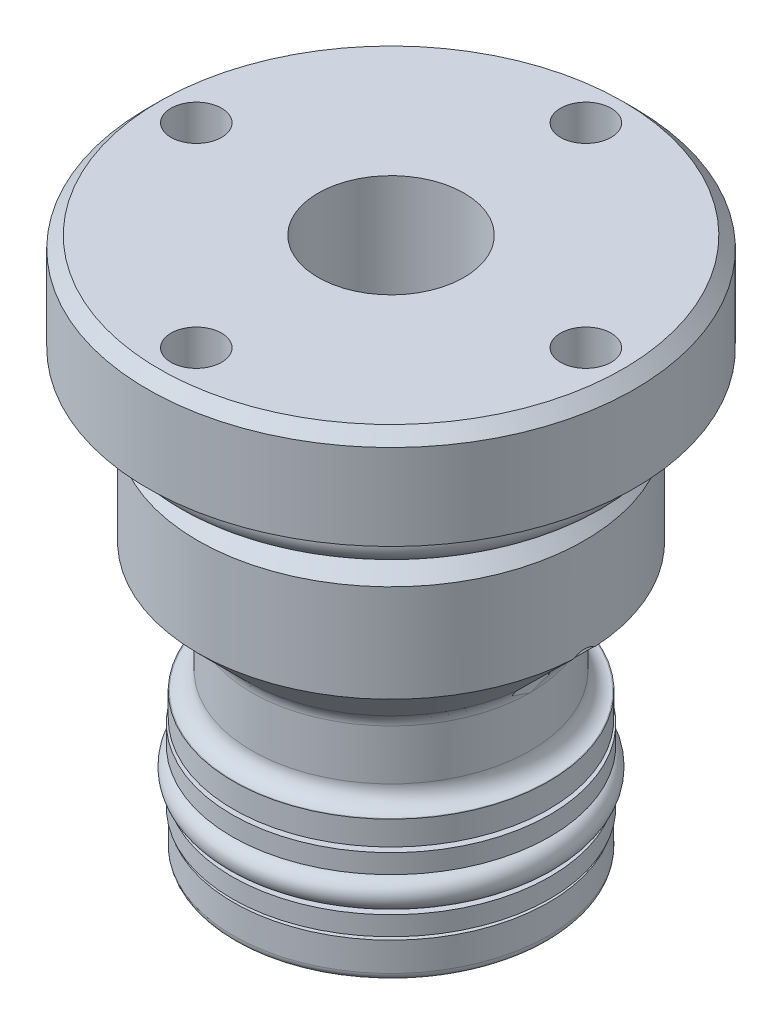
SolidWorks part; units mm, degrees
ref_plane "Front Plane" through (0, 0, 0) normal (0, 0, 1) x (1, 0, 0)
ref_plane "Top Plane" through (0, 0, 0) normal (0, 1, 0) x (1, 0, 0)
ref_plane "Right Plane" through (0, 0, 0) normal (1, 0, 0) x (0, 0, -1)
sketch "Sketch1" plane through (0, 0, 0) normal (0, 0, 1) x (1, 0, 0)
  line L0 (0, 0) -> (0, 29.1031) construction
  line L1 (-7.9375, 0) -> (-7.9375, 18.2372)
  line L2 (-7.9375, 18.2372) -> (-4.7625, 18.2372)
  line L3 (-4.7625, 18.2372) -> (-4.7625, 34.925)
  line L4 (-4.7625, 34.925) -> (-15.875, 34.925)
  line L5 (-15.875, 34.925) -> (-15.875, 28.575)
  line L6 (-15.875, 28.575) -> (-12.6111, 28.575)
  line L7 (-12.6111, 28.575) -> (-12.6111, 17.6403)
  line L8 (-12.6111, 17.6403) -> (-9.0805, 14.1097)
  line L9 (-9.0805, 14.1097) -> (-9.0805, 9.2202)
  line L10 (-9.0805, 9.2202) -> (-10.2743, 9.2202)
  line L11 (-10.2743, 9.2202) -> (-10.2743, 7.6454)
  line L12 (-10.2743, 7.6454) -> (-9.017, 7.6454)
  line L13 (-9.017, 7.6454) -> (-9.017, 2.3876)
  line L14 (-9.017, 2.3876) -> (-10.2743, 2.3876)
  line L15 (-10.2743, 2.3876) -> (-10.2743, 0)
  line L16 (-10.2743, 0) -> (-7.9375, 0)
  dimension "D1" = 18.2372
  dimension "D2" = 34.925
  dimension "D3" = 31.75
  dimension "D4" = 9.525
  dimension "D5" = 15.875
  dimension "D6" = 20.5486
  dimension "D7" = 2.3876
  dimension "D8" = 1.5748
  dimension "D9" = 18.034
  dimension "D10" = 5.2578
  dimension "D11" = 28.575
  dimension "D12" = 25.2222
  dimension "D13" = 18.161
  dimension "D14" = 10.9347
  dimension "D15" = 45
revolve "Revolve1" add sketch "Sketch1" angle 360 about L0
fillet "Fillet1" radius 1.143 2 edges at (0, 14.1097, -9.0805) (0, 9.2202, -9.0805)
fillet "Fillet2" radius 0.381 2 edges at (0, 7.6454, -9.017) (0, 2.3876, -9.017)
fillet "Fillet3" radius 0.508 1 edges at (0, 0, -10.2743)
hole_wizard "Hole1" positions "Sketch3" profile "Sketch2" legacy
sketch "Sketch3" plane through (0, 34.925, 0) normal (0, 1, 0) x (-1, 0, 0)
  circle A0 centre (0, 0) radius 12.7 construction
  point P0 (-12.7, 0)
  dimension "D1" = 12.7
sketch "Sketch2" plane through (12.7, 34.925, 0) normal (1, 0, 0) x (0, 0, 1)
  line L0 (0, 0) -> (0, 4.167)
  line L1 (0, 4.167) -> (1.651, 3.175)
  line L2 (1.651, 3.175) -> (1.651, 0)
  line L4 (1.651, 0) -> (0, 0)
  line L6 (0, 4.167) -> (-1.651, 3.175) construction
  line L7 (0, -4.2442) -> (0, 117.3081) construction
  dimension "Diameter" = 3.302
  dimension "Depth" = 3.175
  dimension "Drill Angle" = 118
pattern_circular "CirPattern1" count 4 over 360 about axis through (0, 0, 0) along (0, 1, 0) of "Hole1"
chamfer "Chamfer1" distance 0.762 angle 45 1 edges at (0, 34.925, -15.875)
sketch "Sketch4" plane through (0, 0, 0) normal (0, 0, 1) x (1, 0, 0)
  line L0 (0, 0) -> (0, 41.4124) construction
  line L1 (-12.6111, 28.575) -> (-12.6111, 23.9903)
  line L2 (-12.6111, 28.575) -> (-12.6111, 17.6403) construction
  line L3 (-12.6111, 23.9903) -> (-11.4808, 25.1206)
  line L4 (-11.4808, 25.1206) -> (-11.4808, 28.575)
  line L5 (-12.6111, 28.575) -> (12.6111, 28.575) construction
  line L6 (-11.4808, 28.575) -> (-12.6111, 28.575)
  line L8 (-9.7663, 0) -> (9.7663, 0) construction
  dimension "D1" = 22.9616
  dimension "D3" = 45
  dimension "D4" = 25.1206
revolve "Cut-Revolve1" cut sketch "Sketch4" angle 360 about L0
fillet "Fillet4" radius 0.381 2 edges at (0, 25.1206, -11.4808) (0, 28.575, -11.4808)
sketch "Sketch5" plane through (0, 0, 0) normal (0, 0, 1) x (1, 0, 0)
  line L0 (-15.875, 28.575) -> (15.875, 28.575) construction
  line L1 (0, 0) -> (0, 42.572) construction
  circle A0 centre (-12.7508, 27.2288) radius 1.3081
  dimension "D2" = 2.6162
  dimension "D1" = 1.3462
  dimension "D3" = 25.5016
revolve "Revolve2" add sketch "Sketch5" angle 360 about L1
sketch "Sketch6" plane through (0, 0, 0) normal (0, 0, 1) x (1, 0, 0)
  line L0 (0, 0) -> (0, 49.5791) construction
  line L1 (-9.017, 7.2644) -> (-9.017, 2.7686) construction
  line L2 (-9.017, 6.1468) -> (-10.3632, 6.1468)
  line L3 (-9.017, 6.1468) -> (-9.017, 7.3914)
  line L4 (-9.017, 7.3914) -> (-10.3632, 7.3914)
  line L5 (-10.3632, 6.1468) -> (-10.3632, 7.3914)
  line L6 (-9.017, 5.0165) -> (-17.8863, 5.0165) construction
  line L7 (-10.3632, 3.8862) -> (-10.3632, 2.6416)
  line L8 (-9.017, 2.6416) -> (-10.3632, 2.6416)
  line L9 (-9.017, 3.8862) -> (-9.017, 2.6416)
  line L10 (-9.017, 3.8862) -> (-10.3632, 3.8862)
  line L11 (10.2743, 2.3876) -> (-10.2743, 2.3876) construction
  circle A0 centre (-9.8552, 4.9276) radius 0.889
  dimension "D4" = 1.778
  dimension "D5" = 19.7104
  dimension "D6" = 2.54
  dimension "D1" = 1.2446
  dimension "D2" = 20.7264
  dimension "D3" = 2.2606
revolve "Revolve3" add sketch "Sketch6" angle 360 about L0
sketch "Sketch7" plane through (0, 0, 0) normal (1, 0, 0) x (0, 0, -1)
  line L0 (-9.7663, 0) -> (9.7663, 0) construction
  circle A0 centre (0, 16.6878) radius 1.1811
  dimension "D1" = 2.3622
  dimension "D2" = 16.6878
extrude "Cut-Extrude1" cut sketch "Sketch7" against normal through all and the other way through all
sketch "Sketch8" plane through (0, 0, 0) normal (1, 0, 0) x (0, 0, -1)
  line L0 (-1.1811, 16.6878) -> (-1.1811, 11.9253)
  line L1 (0, 16.6878) -> (0, 11.9253) construction
  line L2 (1.1811, 16.6878) -> (1.1811, 11.9253)
  arc A0 (1.1811, 16.6878) -> (-1.1811, 16.6878) centre (0, 16.6878) ccw
  arc A1 (-1.1811, 11.9253) -> (1.1811, 11.9253) centre (0, 11.9253) ccw
  arc A2 (-0.6984, 17.6403) -> (0.6984, 17.6403) centre (0, 16.6878) ccw construction
  dimension "D1" = 4.7625
extrude "Cut-Extrude3" cut sketch "Sketch8" along normal blind 25.4 from offset 9.0805
mirror "Mirror1" about plane through (0, 0, 0) normal (1, 0, 0) of "Cut-Extrude3"
